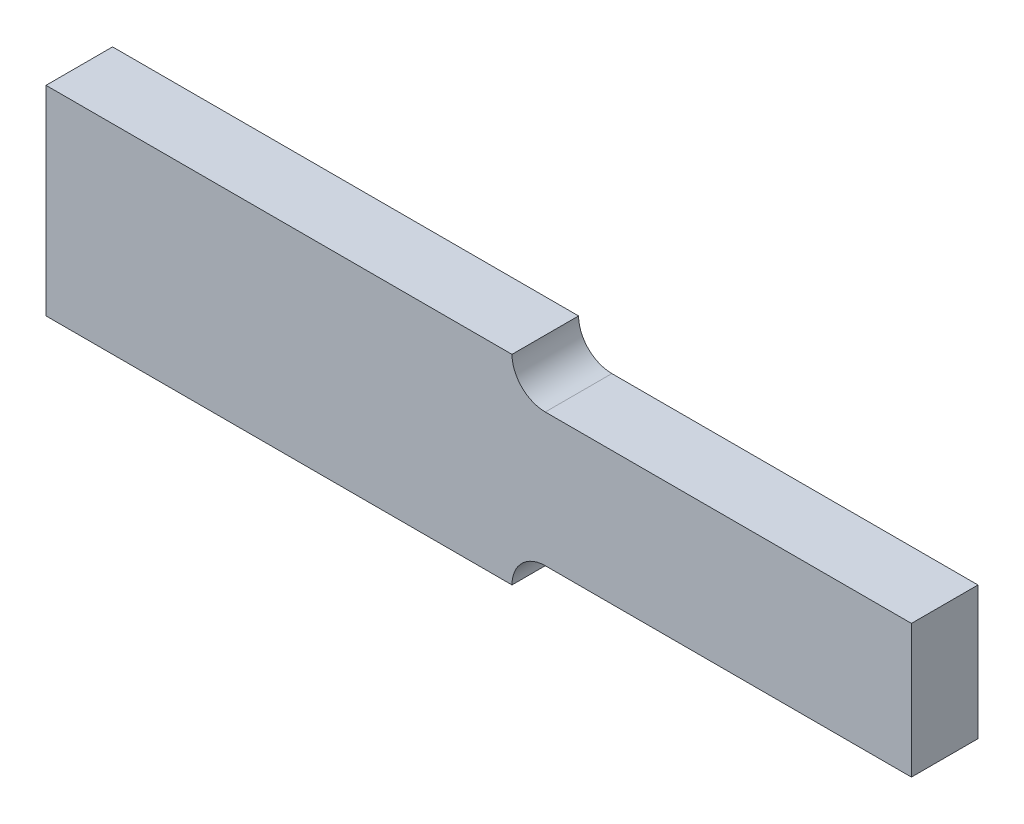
SolidWorks part; units mm, degrees
ref_plane "Ebene vorne" through (0, 0, 0) normal (0, 0, 1) x (1, 0, 0)
ref_plane "Ebene oben" through (0, 0, 0) normal (0, 1, 0) x (1, 0, 0)
ref_plane "Ebene rechts" through (0, 0, 0) normal (1, 0, 0) x (0, 0, -1)
sketch "Skizze1" plane through (0, 0, 0) normal (0, 0, 1) x (1, 0, 0)
  line L0 (0, -30) -> (0, 30)
  line L1 (0, 30) -> (140, 30)
  line L2 (140, 30) -> (140, 20)
  line L3 (140, 20) -> (260, 20)
  line L4 (260, 20) -> (260, -20)
  line L5 (260, -20) -> (140, -20)
  line L6 (140, -20) -> (140, -30)
  line L7 (140, -30) -> (0, -30)
  line L8 (-10.5417, 0) -> (297.9299, 0) construction
  dimension "D1" = 60
  dimension "D2" = 140
  dimension "D3" = 40
  dimension "D4" = 260
extrude "Aufsatz-Linear austragen1" add sketch "Skizze1" along normal blind 20
fillet "Verrundung1" radius 10 2 edges at (140, -20, 10) (140, 20, 10)
